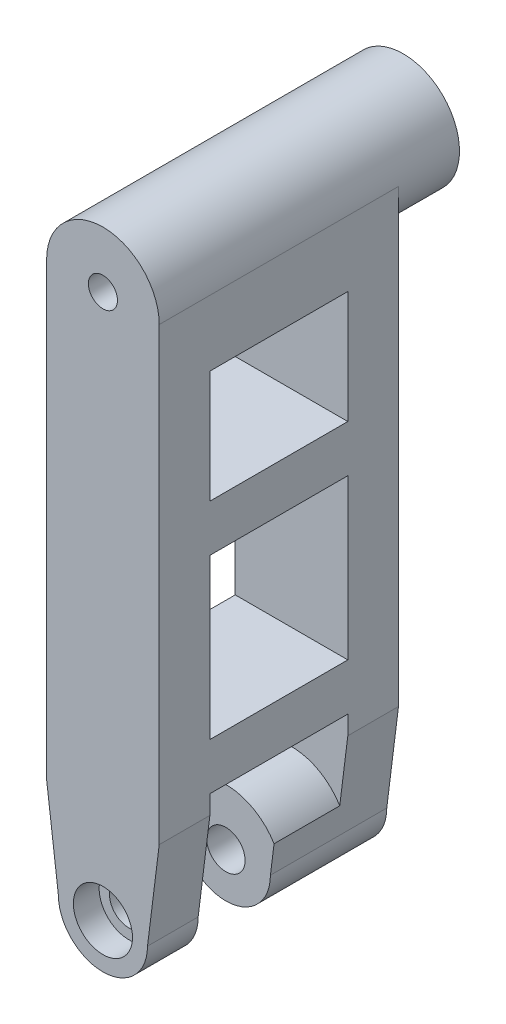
SolidWorks part; units mm, degrees
ref_plane "前视基准面" through (0, 0, 0) normal (0, 0, 1) x (1, 0, 0)
ref_plane "上视基准面" through (0, 0, 0) normal (0, 1, 0) x (1, 0, 0)
ref_plane "右视基准面" through (0, 0, 0) normal (1, 0, 0) x (0, 0, -1)
other "Configuration Table"
sketch "草图1" plane through (0, 0, 0) normal (0, 0, 1) x (1, 0, 0)
  line L2 (0, 0) -> (0, 58)
  line L4 (12, 0) -> (12, 58)
  arc A0 (0, 58) -> (12, 58) centre (6, 58) cw
  arc A1 (12, 0) -> (0, 0) centre (6, 0) cw
  circle A2 centre (6, 58) radius 1.55
  circle A3 centre (6, 0) radius 2.05
  dimension "D3" = 3.1
  dimension "D1" = 12
  dimension "D2" = 58
extrude "凸台-拉伸7" add sketch "草图1" against normal blind 25.5
sketch "草图6" plane through (12, 0, 0) normal (1, 0, 0) x (0, 0, -1)
  line L1 (5.4, -6) -> (20.1, -6)
  line L2 (5.4, -6) -> (5.4, 12)
  line L3 (5.4, 12) -> (20.1, 12)
  line L4 (20.1, -6) -> (20.1, 12)
  line L5 (0, 0) -> (0, -6) construction
  line L7 (5.4, 17) -> (20.1, 17)
  line L8 (5.4, 17) -> (5.4, 34)
  line L9 (5.4, 34) -> (20.1, 34)
  line L10 (20.1, 17) -> (20.1, 34)
  line L15 (5.4, 39) -> (20.1, 39)
  line L24 (5.4, 39) -> (5.4, 51)
  line L25 (5.4, 51) -> (20.1, 51)
  line L26 (20.1, 39) -> (20.1, 51)
  dimension "D6" = 12
  dimension "D1" = 14.7
  dimension "D2" = 5.4
  dimension "D3" = 5
  dimension "D4" = 5
  dimension "D5" = 17
extrude "切除-拉伸1" cut sketch "草图6" against normal blind 20
ref_plane "中间基准面1" through (0, 0, -12.75) normal (0, 0, -1) x (-1, 0, 0)
sketch "草图8" plane through (0, 0, -12.75) normal (0, 0, -1) x (-1, 0, 0)
  line L0 (-6, 58) -> (-6, 0) construction
  line L1 (-6, 58) -> (-9.0127, 70.646) construction
  line L2 (-12, 58) -> (-12, 56.4998)
  line L3 (-12, 0) -> (-12, 58) construction
  line L4 (-12, 56.4998) -> (-8.2378, 61.5313)
  line L5 (-8.2378, 61.5313) -> (-2.7489, 61.5313)
  line L6 (-2.7489, 61.5313) -> (0, 56.0424)
  line L7 (0, 58) -> (0, 0) construction
  line L8 (0, 56.0424) -> (0, 58)
  circle A0 centre (-9.0127, 70.646) radius 4.58
  circle A1 centre (-9.0127, 70.646) radius 7.65 construction
  arc A4 (-12, 58) -> (-15.0878, 65.9966) centre (-23.8986, 58) ccw
  arc A5 (0, 58) -> (-1.5208, 72.1932) centre (-66.9905, 58) ccw
  arc A6 (-1.5208, 72.1932) -> (-15.0878, 65.9966) centre (-8.9807, 70.5759) ccw
extrude "凸台-拉伸8" add sketch "草图8" against normal blind 12.75 and the other way blind 4.05
sketch "草图11" plane through (0, 0, -16.8) normal (0, 0, -1) x (-1, 0, 0)
  line L0 (-12, 58) -> (-39.7806, 58)
  line L1 (-39.7806, 58) -> (-39.7806, 86.9666)
  line L2 (-39.7806, 86.9666) -> (14.0376, 86.9666)
  line L3 (14.0376, 86.9666) -> (14.0376, 58)
  line L4 (14.0376, 58) -> (0, 58)
  arc A0 (-12, 58) -> (0, 58) centre (-6, 58) cw
extrude "切除-拉伸4" cut sketch "草图11" against normal blind 30
sketch "草图12" plane through (0, 0, -25.5) normal (0, 0, -1) x (-1, 0, 0)
  circle A0 centre (-6, 58) radius 6
  dimension "D1" = 12
extrude "凸台-拉伸9" add sketch "草图12" along normal blind 6.5 contours A0 M6 M3
sketch "草图13" plane through (0, 0, -20.1) normal (0, 0, 1) x (1, 0, 0)
  circle A0 centre (6, 0) radius 6
  dimension "D1" = 12
extrude "凸台-拉伸10" add sketch "草图13" along normal blind 7 contours A0 M2 M6
sketch "草图14" plane through (0, 0, -25.5) normal (0, 0, -1) x (-1, 0, 0)
  line L0 (-10.75, 0) -> (-12, 10)
  line L1 (-12, 0) -> (-12, 58) construction
  line L2 (-1.25, 0) -> (0, 10)
  line L3 (0, 58) -> (0, 0) construction
  line L4 (0, 10) -> (-12, 10)
  circle A0 centre (-6, 0) radius 4.75
  dimension "D1" = 9.5
  dimension "D2" = 10
extrude "切除-拉伸5" cut sketch "草图14" against normal through all contours A0 L0 L2 M4 M5 M6
sketch "草图15" plane through (0, 0, -25.5) normal (0, 0, -1) x (-1, 0, 0)
  line L0 (-12, 10) -> (-12, 58) construction
  line L1 (-4.3257, 2.9) -> (-7.6743, 2.9)
  line L2 (-7.6743, 2.9) -> (-9.3486, 0)
  line L3 (-9.3486, 0) -> (-7.6743, -2.9)
  line L4 (-7.6743, -2.9) -> (-4.3257, -2.9)
  line L5 (-4.3257, -2.9) -> (-2.6514, 0)
  line L6 (-2.6514, 0) -> (-4.3257, 2.9)
  circle A0 centre (-6, 0) radius 2.9 construction
  dimension "D1" = 5.8
extrude "切除-拉伸6" cut sketch "草图15" against normal blind 2.75
sketch "草图16" plane through (0, 0, 0) normal (0, 0, 1) x (1, 0, 0)
  circle A0 centre (6, 0) radius 3.15
  dimension "D1" = 6.3
extrude "切除-拉伸7" cut sketch "草图16" against normal blind 2.75
